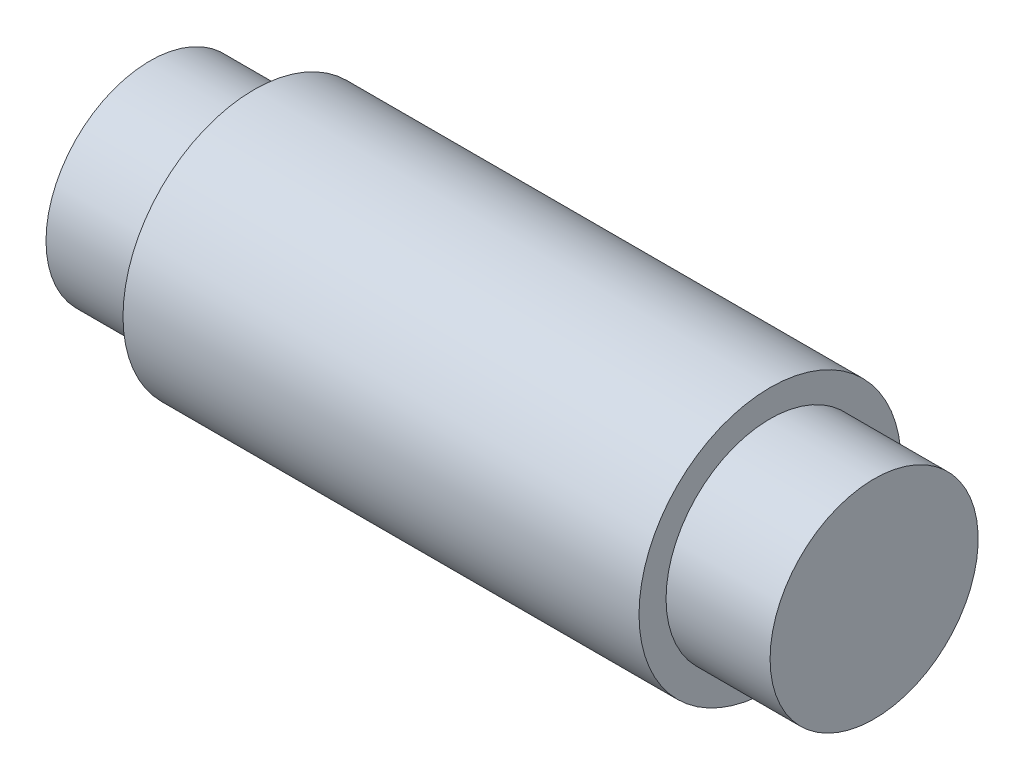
SolidWorks part; units mm, degrees
ref_plane "Front Plane" through (0, 0, 0) normal (0, 0, 1) x (1, 0, 0)
ref_plane "Top Plane" through (0, 0, 0) normal (0, 1, 0) x (1, 0, 0)
ref_plane "Right Plane" through (0, 0, 0) normal (1, 0, 0) x (0, 0, -1)
sketch "Sketch1" plane through (0, 0, 0) normal (0, 0, 1) x (1, 0, 0)
  line L0 (-11.049, 0) -> (11.049, 0)
  line L1 (11.049, 0) -> (11.049, 3.175)
  line L2 (-11.049, 3.175) -> (-7.874, 3.175)
  line L3 (-7.874, 3.175) -> (-7.874, 4)
  line L4 (-7.874, 4) -> (7.874, 4)
  line L5 (7.874, 3.175) -> (7.874, 4)
  line L6 (7.874, 3.175) -> (11.049, 3.175)
  line L8 (11.049, 0) -> (33.3522, 0) construction
  line L9 (0, 0) -> (0, 10.2577) construction
  line L10 (-11.049, 0) -> (-11.049, 3.175)
  point P9 (0, 4)
  dimension "D1" = 6.35
  dimension "D2" = 15.748
  dimension "D3" = 8
  dimension "D4" = 22.098
  dimension "D5" = 22.098
revolve "Revolve1" add sketch "Sketch1" angle 360 about L8
